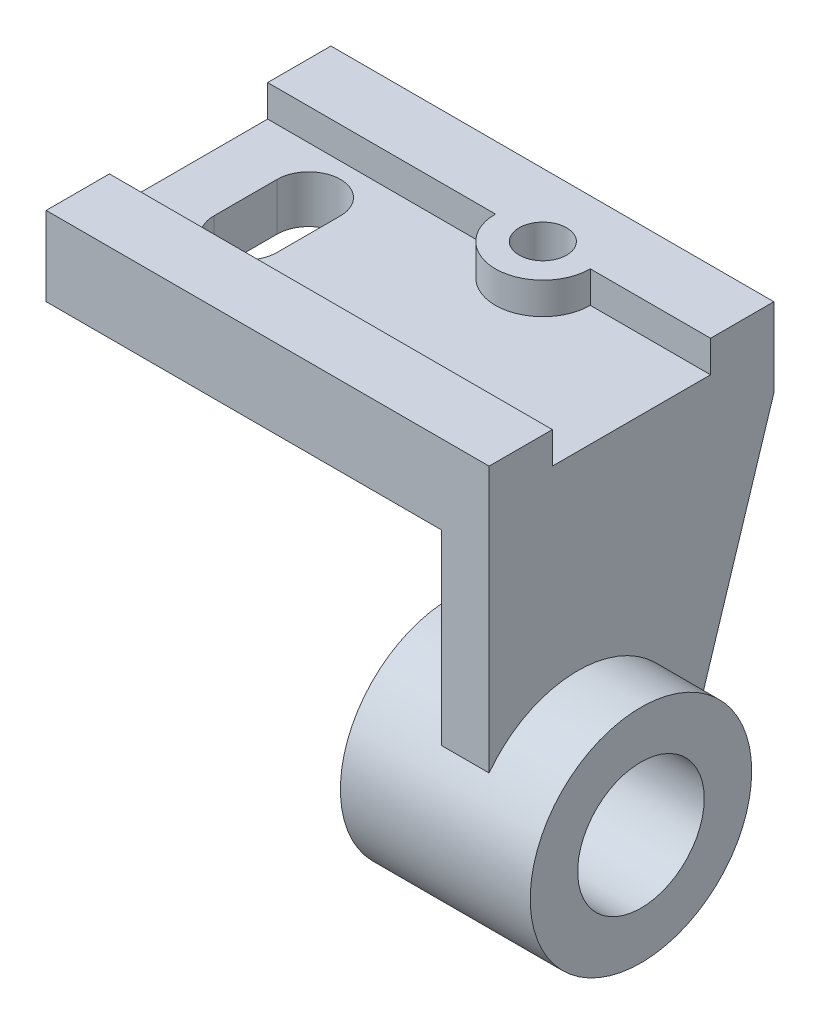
SolidWorks part; units mm, degrees
ref_plane "前视基准面" through (0, 0, 0) normal (0, 0, 1) x (1, 0, 0)
ref_plane "上视基准面" through (0, 0, 0) normal (0, 1, 0) x (1, 0, 0)
ref_plane "右视基准面" through (0, 0, 0) normal (1, 0, 0) x (0, 0, -1)
sketch "草图1" plane through (0, 0, 0) normal (0, 1, 0) x (1, 0, 0)
  line L1 (0, 0) -> (-140, 0)
  line L2 (0, 0) -> (0, -90)
  line L3 (0, -90) -> (-140, -90)
  line L4 (-140, 0) -> (-140, -90)
  dimension "D1" = 140
  dimension "D2" = 90
extrude "拉伸1" add sketch "草图1" along normal blind 25
sketch "草图2" plane through (0, 25, 0) normal (0, 1, 0) x (1, 0, 0)
  line L0 (-140, -20) -> (-68, -20)
  line L1 (-140, 0) -> (-140, -90) construction
  line L2 (-38, -20) -> (0, -20)
  line L3 (0, -90) -> (0, 0) construction
  line L4 (0, -20) -> (0, -70)
  line L5 (0, -70) -> (-140, -70)
  line L6 (-140, -70) -> (-140, -20)
  line L7 (-140, -45) -> (5.9898, -45) construction
  arc A0 (-68, -20) -> (-38, -20) centre (-53, -20) ccw
  dimension "D2" = 15
  dimension "D1" = 50
  dimension "D3" = 38
extrude "切除-拉伸1" cut sketch "草图2" against normal blind 10
sketch "草图3" plane through (0, 25, 0) normal (0, 1, 0) x (1, 0, 0)
  circle A0 centre (-53, -20) radius 7.5
  arc A1 (-68, -20) -> (-38, -20) centre (-53, -20) ccw construction
  dimension "D1" = 15
extrude "切除-拉伸2" cut sketch "草图3" against normal through all
sketch "草图4" plane through (0, 15, 0) normal (0, 1, 0) x (1, 0, 0)
  line L0 (-112, -95.5109) -> (-112, -6.5581) construction
  line L1 (-122, -35) -> (-122, -55)
  line L2 (-102, -55) -> (-102, -35)
  line L3 (-140, -20) -> (-140, -70) construction
  line L4 (-140, -45) -> (-61.954, -45) construction
  arc A0 (-122, -55) -> (-102, -55) centre (-112, -55) ccw
  arc A1 (-102, -35) -> (-122, -35) centre (-112, -35) ccw
  dimension "D3" = 10
  dimension "D1" = 28
  dimension "D2" = 20
extrude "切除-拉伸3" cut sketch "草图4" against normal through all
ref_plane "基准面1" through (-40, 0, 0) normal (1, 0, 0) x (0, 0, -1)
sketch "草图5" plane through (-40, 0, 0) normal (1, 0, 0) x (0, 0, -1)
  line L0 (0, 0) -> (-138.0282, 0) construction
  line L1 (-138.0282, 0) -> (0, 0) construction
  line L2 (0, 0) -> (0, -79.9401) construction
  circle A0 centre (-62, -80) radius 35
  circle A1 centre (-62, -80) radius 20
  dimension "D1" = 70
  dimension "D2" = 40
  dimension "D3" = 80
  dimension "D4" = 62
extrude "拉伸2" add sketch "草图5" along normal blind 60
sketch "草图6" plane through (0, 0, 0) normal (1, 0, 0) x (0, 0, -1)
  line L0 (0, 0) -> (-28.6281, -90.5507)
  line L1 (0, 0) -> (-90, 0)
  line L2 (-90, 0) -> (-90, -59)
  circle A0 centre (-62, -80) radius 35 construction
  arc A1 (-90, -59) -> (-28.6281, -90.5507) centre (-62, -80) cw
extrude "拉伸3" add sketch "草图6" against normal blind 15
